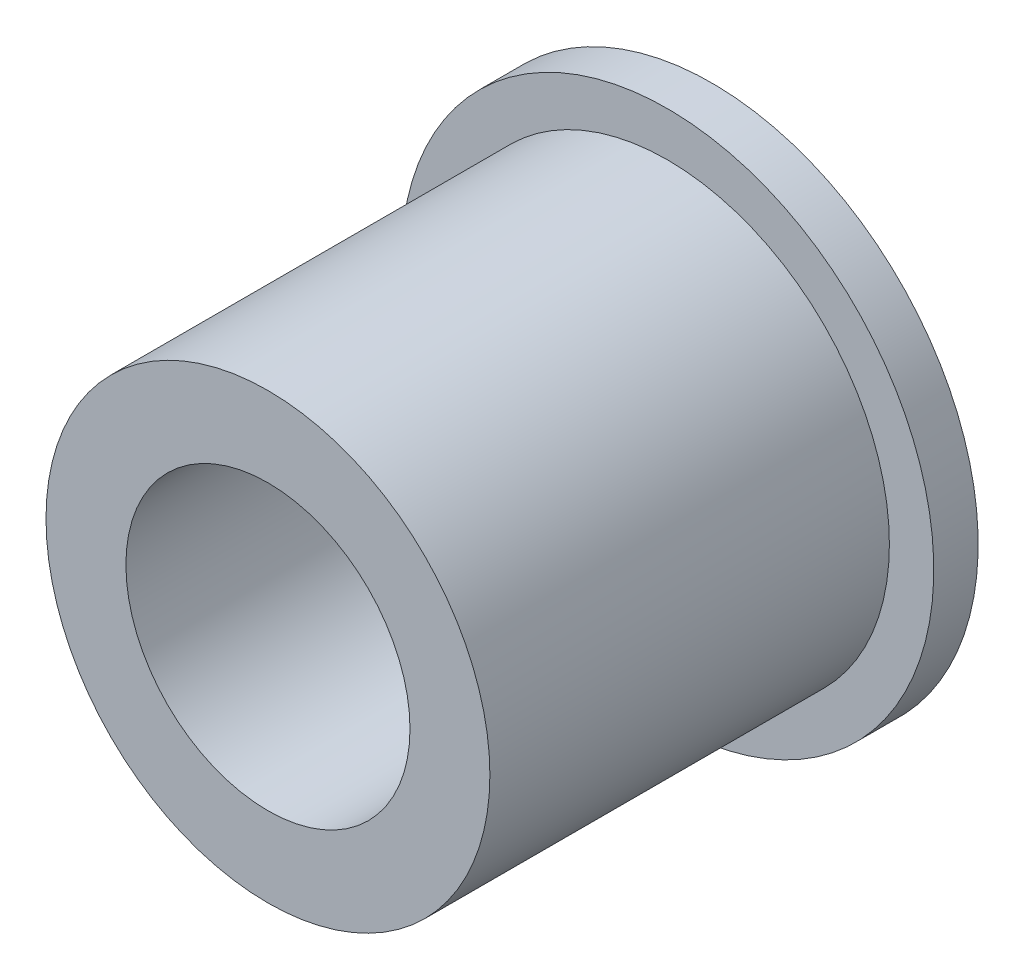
SolidWorks part; units mm, degrees
ref_plane "Plan de face" through (0, 0, 0) normal (0, 0, 1) x (1, 0, 0)
ref_plane "Plan de dessus" through (0, 0, 0) normal (0, 1, 0) x (1, 0, 0)
ref_plane "Plan de droite" through (0, 0, 0) normal (1, 0, 0) x (0, 0, -1)
sketch "Esquisse1" plane through (0, 0, 0) normal (0, 0, 1) x (1, 0, 0)
  circle A0 centre (0, 0) radius 25
  circle A1 centre (0, 0) radius 16
  dimension "D1" = 32
  dimension "D2" = 50
extrude "Extrusion1" add sketch "Esquisse1" along normal blind 50
sketch "Esquisse3" plane through (0, 0, 0) normal (0, 0, -1) x (-1, 0, 0)
  circle A0 centre (0, 0) radius 25
  circle A1 centre (0, 0) radius 30
  dimension "D1" = 60
extrude "Extrusion3" add sketch "Esquisse3" against normal blind 5
